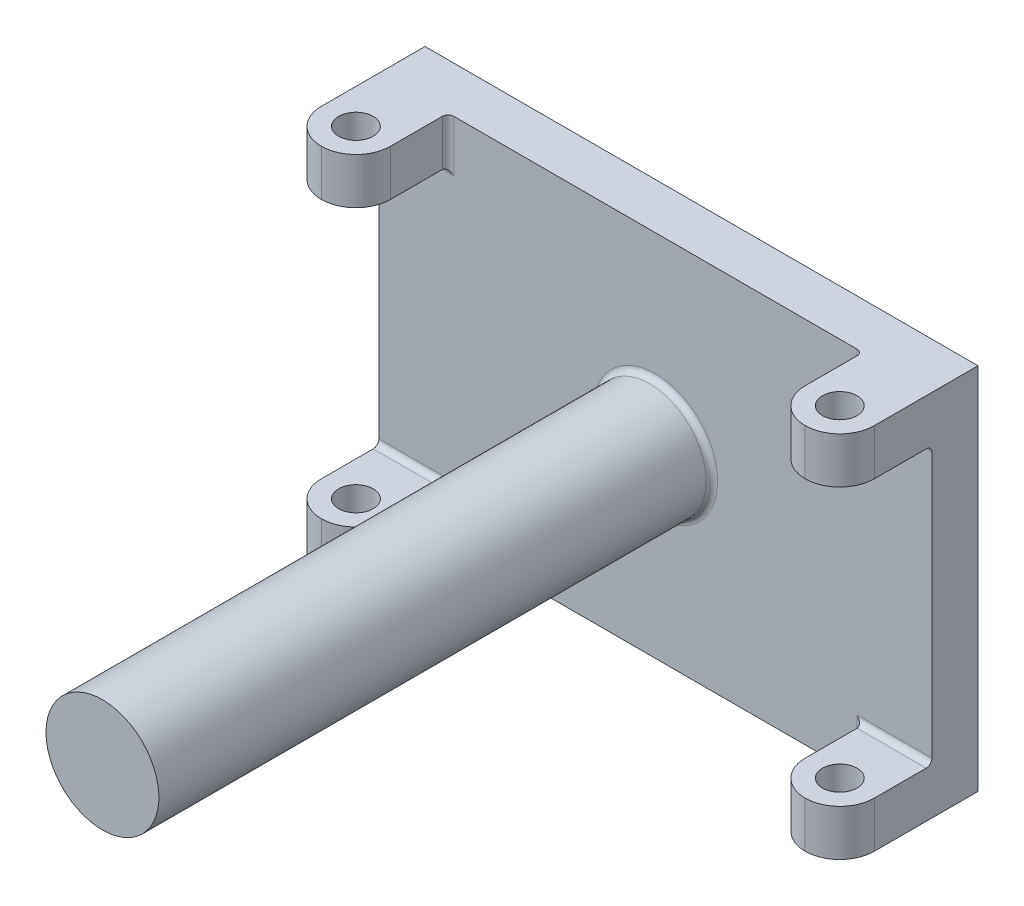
SolidWorks part; units mm, degrees
ref_plane "Front Plane" through (0, 0, 0) normal (0, 0, 1) x (1, 0, 0)
ref_plane "Top Plane" through (0, 0, 0) normal (0, 1, 0) x (1, 0, 0)
ref_plane "Right Plane" through (0, 0, 0) normal (1, 0, 0) x (0, 0, -1)
sketch "Sketch2" plane through (0, 0, 0) normal (0, 0, 1) x (1, 0, 0)
  line L0 (0, 0) -> (137.829, 0) construction
  line L1 (0, 0) -> (0, 93.6852) construction
  line L3 (-152.4, -101.6) -> (152.4, -101.6)
  line L4 (-152.4, -101.6) -> (-152.4, 101.6)
  line L5 (-152.4, 101.6) -> (152.4, 101.6)
  line L6 (152.4, -101.6) -> (152.4, 101.6)
  dimension "D1" = 304.8
  dimension "D2" = 203.2
  dimension "D3" = 152.4
  dimension "D4" = 101.6
extrude "Extrude2" add sketch "Sketch2" along normal blind 25.4
sketch "Sketch3" plane through (0, 0, 25.4) normal (0, 0, 1) x (1, 0, 0)
  line L1 (-152.4, -101.6) -> (-114.3, -101.6)
  line L2 (-152.4, -101.6) -> (-152.4, -76.2)
  line L3 (-152.4, -76.2) -> (-114.3, -76.2)
  line L4 (-114.3, -101.6) -> (-114.3, -76.2)
  dimension "D1" = 38.1
  dimension "D2" = 25.4
extrude "Extrude3" add sketch "Sketch3" along normal blind 50.8
fillet "Fillet1" radius 19.05 2 edges at (-114.3, -88.9, 76.2) (-152.4, -88.9, 76.2)
sketch "Sketch4" plane through (0, -101.6, 0) normal (0, -1, 0) x (1, 0, 0)
  circle A0 centre (-133.35, 57.15) radius 9.525
  arc A1 (-133.35, 76.2) -> (-152.4, 57.15) centre (-133.35, 57.15) ccw construction
  dimension "D1" = 19.05
extrude "Cut-Extrude1" cut sketch "Sketch4" against normal through all
mirror "Mirror1" about plane through (0, 0, 0) normal (1, 0, 0) of "Cut-Extrude1", "Fillet1", "Extrude3"
mirror "Mirror2" about plane through (0, 0, 0) normal (0, 1, 0) of "Mirror1", "Cut-Extrude1", "Fillet1", "Extrude3"
sketch "Sketch5" plane through (0, 0, 25.4) normal (0, 0, 1) x (1, 0, 0)
  circle A0 centre (0, 0) radius 31.115
  dimension "D1" = 62.23
extrude "Boss-Extrude1" add sketch "Sketch5" along normal blind 304.8
fillet "Fillet2" radius 3.175 9 edges at (114.3, 88.9, 25.4) (114.3, -88.9, 25.4) (-114.3, 88.9, 25.4) (-133.35, 76.2, 25.4) (133.35, 76.2, 25.4) (133.35, -76.2, 25.4) (-31.115, 0, 25.4)
equation "\"D3@Sketch2\" = \"D1@Sketch2\"/2"
